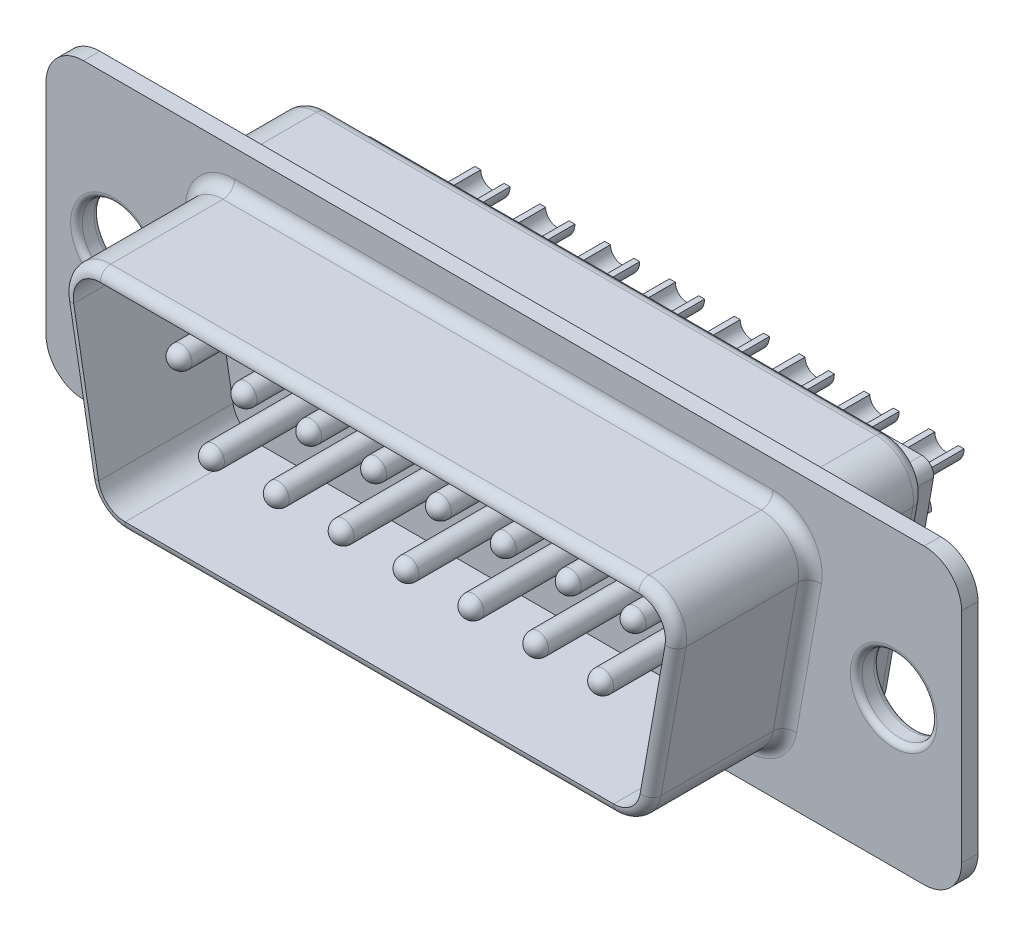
SolidWorks part; units mm, degrees
ref_plane "Front" through (0, 0, 0) normal (0, 0, 1) x (1, 0, 0)
ref_plane "Top" through (0, 0, 0) normal (0, 1, 0) x (1, 0, 0)
ref_plane "Right" through (0, 0, 0) normal (1, 0, 0) x (0, 0, -1)
sketch "Sketch1" plane through (0, 0, 0) normal (0, 0, 1) x (1, 0, 0)
  line L0 (0, 15.7999) -> (0, -16.2156) construction
  line L1 (-17.95, 6.265) -> (17.95, 6.265)
  line L2 (-19.55, 4.665) -> (-19.55, -4.665)
  line L3 (-17.95, -6.265) -> (17.95, -6.265)
  line L4 (19.55, 4.665) -> (19.55, -4.665)
  line L5 (-25.5708, 0) -> (26.8182, 0) construction
  arc A0 (17.95, 6.265) -> (19.55, 4.665) centre (17.95, 4.665) cw
  arc A1 (17.95, -6.265) -> (19.55, -4.665) centre (17.95, -4.665) ccw
  arc A2 (-19.55, -4.665) -> (-17.95, -6.265) centre (-17.95, -4.665) ccw
  arc A3 (-17.95, 6.265) -> (-19.55, 4.665) centre (-17.95, 4.665) ccw
  point P10 (19.55, 6.265)
  point P13 (19.55, -6.265)
  point P18 (-19.55, 6.265)
  dimension "D5" = 1.6
  dimension "D1" = 39.1
  dimension "D2" = 19.55
  dimension "D3" = 12.53
  dimension "D4" = 6.265
extrude "Extrude1" add sketch "Sketch1" against normal blind 0.7
sketch "Sketch2" plane through (0, 0, 0) normal (0, 0, 1) x (1, 0, 0)
  line L0 (0, -11.2848) -> (0, 18.2623) construction
  circle A0 centre (16.65, 0) radius 1.6
  circle A1 centre (-16.65, 0) radius 1.6
  dimension "D1" = 3.2
  dimension "D2" = 16.65
extrude "Cut-Extrude1" cut sketch "Sketch2" against normal through all
sketch "Sketch3" plane through (0, 0, 0) normal (0, 0, 1) x (1, 0, 0)
  line L0 (-11.4943, 4.615) -> (11.4943, 4.615)
  line L1 (-10.4311, -4.615) -> (10.4311, -4.615)
  line L2 (0, 11.4353) -> (0, -12.3443) construction
  line L3 (13.07, 2.7372) -> (12.0067, -3.2928)
  line L4 (-13.07, 2.7372) -> (-12.0067, -3.2928)
  arc A0 (11.4943, 4.615) -> (13.07, 2.7372) centre (11.4943, 3.015) cw
  arc A1 (-13.07, 2.7372) -> (-11.4943, 4.615) centre (-11.4943, 3.015) cw
  arc A2 (-10.4311, -4.615) -> (-12.0067, -3.2928) centre (-10.4311, -3.015) cw
  arc A3 (12.0067, -3.2928) -> (10.4311, -4.615) centre (10.4311, -3.015) cw
  dimension "D1" = 1.6
  dimension "D2" = 26.14
  dimension "D4" = 10
  dimension "D7" = 13.07
  dimension "D3" = 10
  dimension "D5" = 4.615
  dimension "D6" = 9.23
extrude "Extrude2" add sketch "Sketch3" along normal blind 5.74
fillet "Fillet1" radius 0.45 8 edges at (12.5384, -0.2778, 5.74) (11.4595, -4.2407, 5.74) (0, -4.615, 5.74) (-11.4595, -4.2407, 5.74) (-12.5384, -0.2778, 5.74) (-12.72, 4.0435, 5.74) (0, 4.615, 5.74) (12.72, 4.0435, 5.74)
sketch "Sketch4" plane through (0, 0, 5.74) normal (0, 0, 1) x (1, 0, 0)
  line L4 (11.5636, -3.2147) -> (12.6268, 2.8153)
  line L5 (11.4943, 4.165) -> (-11.4943, 4.165)
  line L6 (-12.6268, 2.8153) -> (-11.5636, -3.2147)
  line L7 (-10.4311, -4.165) -> (10.4311, -4.165)
  line L8 (11.5636, -3.2147) -> (12.6268, 2.8153)
  line L9 (11.4943, 4.165) -> (-11.4943, 4.165)
  line L10 (-12.6268, 2.8153) -> (-11.5636, -3.2147)
  line L11 (-10.4311, -4.165) -> (10.4311, -4.165)
  arc A4 (10.4311, -4.165) -> (11.5636, -3.2147) centre (10.4311, -3.015) ccw
  arc A5 (12.6268, 2.8153) -> (11.4943, 4.165) centre (11.4943, 3.015) ccw
  arc A6 (-11.4943, 4.165) -> (-12.6268, 2.8153) centre (-11.4943, 3.015) ccw
  arc A7 (-11.5636, -3.2147) -> (-10.4311, -4.165) centre (-10.4311, -3.015) ccw
  arc A8 (10.4311, -4.165) -> (11.5636, -3.2147) centre (10.4311, -3.015) ccw
  arc A9 (12.6268, 2.8153) -> (11.4943, 4.165) centre (11.4943, 3.015) ccw
  arc A10 (-11.4943, 4.165) -> (-12.6268, 2.8153) centre (-11.4943, 3.015) ccw
  arc A11 (-11.5636, -3.2147) -> (-10.4311, -4.165) centre (-10.4311, -3.015) ccw
  dimension "D1" = 0
extrude "Cut-Extrude2" cut sketch "Sketch4" against normal up to surface (5.74 mm away)
sketch "Sketch5" plane through (0, 0, 0) normal (0, 0, 1) x (1, 0, 0)
  line L0 (0, 7.7989) -> (0, -8.8516) construction
  line L1 (-16.65, 0) -> (16.65, 0) construction
  line L2 (0, -1.5) -> (2.77, -1.5) construction
  line L3 (0, -1.5) -> (-2.77, -1.5) construction
  line L4 (1.385, 1.5) -> (4.155, 1.5) construction
  line L5 (1.385, 1.5) -> (-1.385, 1.5) construction
  circle A0 centre (0, -1.5) radius 0.46
  circle A1 centre (2.77, -1.5) radius 0.46
  circle A2 centre (5.54, -1.5) radius 0.46
  circle A3 centre (8.31, -1.5) radius 0.46
  circle A4 centre (-2.77, -1.5) radius 0.46
  circle A5 centre (0, -1.5) radius 0.46
  circle A6 centre (2.77, -1.5) radius 0.46
  circle A7 centre (5.54, -1.5) radius 0.46
  circle A8 centre (-5.54, -1.5) radius 0.46
  circle A9 centre (-2.77, -1.5) radius 0.46
  circle A10 centre (0, -1.5) radius 0.46
  circle A11 centre (2.77, -1.5) radius 0.46
  circle A12 centre (-8.31, -1.5) radius 0.46
  circle A13 centre (-5.54, -1.5) radius 0.46
  circle A14 centre (-2.77, -1.5) radius 0.46
  circle A15 centre (0, -1.5) radius 0.46
  circle A16 centre (1.385, 1.5) radius 0.46
  circle A17 centre (4.155, 1.5) radius 0.46
  circle A18 centre (6.925, 1.5) radius 0.46
  circle A19 centre (9.695, 1.5) radius 0.46
  circle A20 centre (-1.385, 1.5) radius 0.46
  circle A21 centre (1.385, 1.5) radius 0.46
  circle A22 centre (4.155, 1.5) radius 0.46
  circle A23 centre (6.925, 1.5) radius 0.46
  circle A24 centre (-4.155, 1.5) radius 0.46
  circle A25 centre (-1.385, 1.5) radius 0.46
  circle A26 centre (1.385, 1.5) radius 0.46
  circle A27 centre (4.155, 1.5) radius 0.46
  circle A28 centre (-6.925, 1.5) radius 0.46
  circle A29 centre (-4.155, 1.5) radius 0.46
  circle A30 centre (-1.385, 1.5) radius 0.46
  circle A31 centre (1.385, 1.5) radius 0.46
  circle A32 centre (-9.695, 1.5) radius 0.46
  circle A33 centre (-6.925, 1.5) radius 0.46
  circle A34 centre (-4.155, 1.5) radius 0.46
  circle A35 centre (-1.385, 1.5) radius 0.46
  dimension "D1" = 0.92
  dimension "D2" = 1.5
  dimension "D3" = 1.385
  dimension "D4" = 1.5
sketch "Sketch6" plane through (0, 0, -0.7) normal (0, 0, -1) x (-1, 0, 0)
  line L0 (0, 8.0382) -> (0, -10.1913) construction
  line L1 (-16.65, 0) -> (16.65, 0) construction
  line L2 (-11.7441, 3.46) -> (11.7441, 3.46)
  line L4 (-11.9432, 5.385) -> (11.9432, 5.385)
  line L5 (13.5189, 3.5072) -> (12.1841, -4.0628)
  line L6 (-10.6084, -5.385) -> (10.6084, -5.385)
  line L7 (-13.5189, 3.5072) -> (-12.1841, -4.0628)
  line L8 (-10.7003, -3.46) -> (10.7003, -3.46)
  line L10 (12.2365, 2.8732) -> (11.1927, -3.0468)
  line L11 (-12.2365, 2.8732) -> (-11.1927, -3.0468)
  arc A0 (-11.9432, 5.385) -> (-13.5189, 3.5072) centre (-11.9432, 3.785) ccw
  arc A1 (13.5189, 3.5072) -> (11.9432, 5.385) centre (11.9432, 3.785) ccw
  arc A2 (10.6084, -5.385) -> (12.1841, -4.0628) centre (10.6084, -3.785) ccw
  arc A3 (-12.1841, -4.0628) -> (-10.6084, -5.385) centre (-10.6084, -3.785) ccw
  arc A4 (11.7441, 3.46) -> (12.2365, 2.8732) centre (11.7441, 2.96) cw
  arc A5 (-11.7441, 3.46) -> (-12.2365, 2.8732) centre (-11.7441, 2.96) ccw
  arc A6 (-10.7003, -3.46) -> (-11.1927, -3.0468) centre (-10.7003, -2.96) cw
  arc A7 (11.1927, -3.0468) -> (10.7003, -3.46) centre (10.7003, -2.96) cw
  dimension "D1" = 1.6
  dimension "D6" = 11.9432
  dimension "D7" = 11.9432
  dimension "D10" = 0.5
  dimension "D3" = 5.385
  dimension "D4" = 10
  dimension "D2" = 10.77
  dimension "D5" = 20
  dimension "D8" = 1.925
extrude "Extrude3" add sketch "Sketch6" along normal blind 3.75
fillet "Fillet2" radius 0.5 8 edges at (-13.1689, 4.8135, -4.45) (-12.8515, -0.2778, -4.45) (-11.6369, -5.0107, -4.45) (0, -5.385, -4.45) (11.6369, -5.0107, -4.45) (12.8515, -0.2778, -4.45) (13.1689, 4.8135, -4.45) (0, 5.385, -4.45)
sketch "Sketch7" plane through (0, 0, -0.7) normal (0, 0, -1) x (-1, 0, 0)
  line L4 (11.7441, 3.46) -> (-11.7441, 3.46)
  line L5 (-12.2365, 2.8732) -> (-11.1927, -3.0468)
  line L6 (-10.7003, -3.46) -> (10.7003, -3.46)
  line L7 (11.1927, -3.0468) -> (12.2365, 2.8732)
  line L8 (11.7441, 3.46) -> (-11.7441, 3.46)
  line L9 (-12.2365, 2.8732) -> (-11.1927, -3.0468)
  line L10 (-10.7003, -3.46) -> (10.7003, -3.46)
  line L11 (11.1927, -3.0468) -> (12.2365, 2.8732)
  arc A4 (12.2365, 2.8732) -> (11.7441, 3.46) centre (11.7441, 2.96) ccw
  arc A5 (-11.7441, 3.46) -> (-12.2365, 2.8732) centre (-11.7441, 2.96) ccw
  arc A6 (-11.1927, -3.0468) -> (-10.7003, -3.46) centre (-10.7003, -2.96) ccw
  arc A7 (10.7003, -3.46) -> (11.1927, -3.0468) centre (10.7003, -2.96) ccw
  arc A8 (12.2365, 2.8732) -> (11.7441, 3.46) centre (11.7441, 2.96) ccw
  arc A9 (-11.7441, 3.46) -> (-12.2365, 2.8732) centre (-11.7441, 2.96) ccw
  arc A10 (-11.1927, -3.0468) -> (-10.7003, -3.46) centre (-10.7003, -2.96) ccw
  arc A11 (10.7003, -3.46) -> (11.1927, -3.0468) centre (10.7003, -2.96) ccw
  dimension "D1" = 0
extrude "Extrude4" add sketch "Sketch7" along normal blind 5.41
sketch "Sketch8" plane through (0, 0, -6.11) normal (0, 0, -1) x (-1, 0, 0)
  line L0 (0, 8.7559) -> (0, -8.5166) construction
  line L1 (-16.65, 0) -> (16.65, 0) construction
  line L2 (1.385, 1.5) -> (4.155, 1.5) construction
  line L3 (1.385, 1.5) -> (-1.385, 1.5) construction
  line L4 (0, -1.5) -> (2.77, -1.5) construction
  line L5 (0, -1.5) -> (-2.77, -1.5) construction
  circle A0 centre (0, -1.5) radius 0.75
  circle A1 centre (1.385, 1.5) radius 0.75
  circle A2 centre (4.155, 1.5) radius 0.75
  circle A3 centre (6.925, 1.5) radius 0.75
  circle A4 centre (9.695, 1.5) radius 0.75
  circle A5 centre (-1.385, 1.5) radius 0.75
  circle A6 centre (1.385, 1.5) radius 0.75
  circle A7 centre (4.155, 1.5) radius 0.75
  circle A8 centre (6.925, 1.5) radius 0.75
  circle A9 centre (-4.155, 1.5) radius 0.75
  circle A10 centre (-1.385, 1.5) radius 0.75
  circle A11 centre (1.385, 1.5) radius 0.75
  circle A12 centre (4.155, 1.5) radius 0.75
  circle A13 centre (-6.925, 1.5) radius 0.75
  circle A14 centre (-4.155, 1.5) radius 0.75
  circle A15 centre (-1.385, 1.5) radius 0.75
  circle A16 centre (1.385, 1.5) radius 0.75
  circle A17 centre (-9.695, 1.5) radius 0.75
  circle A18 centre (-6.925, 1.5) radius 0.75
  circle A19 centre (-4.155, 1.5) radius 0.75
  circle A20 centre (-1.385, 1.5) radius 0.75
  circle A21 centre (2.77, -1.5) radius 0.75
  circle A22 centre (5.54, -1.5) radius 0.75
  circle A23 centre (8.31, -1.5) radius 0.75
  circle A24 centre (-2.77, -1.5) radius 0.75
  circle A25 centre (0, -1.5) radius 0.75
  circle A26 centre (2.77, -1.5) radius 0.75
  circle A27 centre (5.54, -1.5) radius 0.75
  circle A28 centre (-5.54, -1.5) radius 0.75
  circle A29 centre (-2.77, -1.5) radius 0.75
  circle A30 centre (0, -1.5) radius 0.75
  circle A31 centre (2.77, -1.5) radius 0.75
  circle A32 centre (-8.31, -1.5) radius 0.75
  circle A33 centre (-5.54, -1.5) radius 0.75
  circle A34 centre (-2.77, -1.5) radius 0.75
  circle A35 centre (0, -1.5) radius 0.75
  dimension "D1" = 1.5
  dimension "D2" = 1.5
  dimension "D3" = 1.5
  dimension "D4" = 1.385
extrude "Extrude5" add sketch "Sketch8" along normal blind 3.1 contours A17 | A13 | A9 | A5 | A1 | A2 | A3 | A4 | A32 | A28 | A24 | A0 | A21 | A22 | A23
ref_plane "Plane1" through (0, 1.5, 0) normal (0, 1, 0) x (-1, 0, 0)
ref_plane "Plane2" through (0, -1.5, 0) normal (0, 1, 0) x (-1, 0, 0)
sketch "Sketch9" plane through (0, 1.5, 0) normal (0, 1, 0) x (-1, 0, 0)
  line L0 (-10.445, -9.21) -> (-8.945, -9.21) construction
  line L1 (-10.445, -9.21) -> (10.445, -9.21)
  line L2 (-10.445, -9.21) -> (-10.445, -7.21)
  line L3 (-10.445, -7.21) -> (10.445, -7.21)
  line L4 (10.445, -9.21) -> (10.445, -7.21)
  line L5 (10.445, -9.21) -> (10.445, -6.11) construction
  line L6 (-10.445, -6.11) -> (-10.445, -9.21) construction
  dimension "D1" = 2
extrude "Cut-Extrude4" cut sketch "Sketch9" along normal blind 3.1
sketch "Sketch10" plane through (0, -1.5, 0) normal (0, 1, 0) x (-1, 0, 0)
  line L1 (-10.445, -9.21) -> (10.445, -9.21)
  line L2 (-10.445, -9.21) -> (-10.445, -7.21)
  line L3 (-10.445, -7.21) -> (10.445, -7.21)
  line L4 (10.445, -9.21) -> (10.445, -7.21)
extrude "Cut-Extrude5" cut sketch "Sketch10" against normal blind 3.1
fillet "Fillet3" radius 0.25 2 edges at (-18.25, 0, 0) (18.25, 0, 0)
sketch "Sketch12" plane through (0, 0, -0.7) normal (0, 0, -1) x (-1, 0, 0)
  circle A0 centre (16.65, 0) radius 1.6 construction
  circle A1 centre (-16.65, 0) radius 1.6 construction
  circle A2 centre (16.65, 0) radius 1.6
  circle A3 centre (-16.65, 0) radius 1.6
  circle A4 centre (-16.65, 0) radius 2.15
  circle A5 centre (16.65, 0) radius 2.15
  dimension "D1" = 4.3
extrude "Extrude6" add sketch "Sketch12" along normal blind 0.3
fillet "Fillet4" radius 0.25 2 edges at (-18.25, 0, -1) (15.05, 0, -1)
fillet "Fillet5" radius 0.5 8 edges at (12.72, 4.0435, 0) (12.5384, -0.2778, 0) (11.4595, -4.2407, 0) (0, -4.615, 0) (-11.4595, -4.2407, 0) (-12.5384, -0.2778, 0) (-12.72, 4.0435, 0) (0, 4.615, 0)
fillet "Fillet6" radius 0.5 8 edges at (-13.1689, 4.8135, -0.7) (-12.8515, -0.2778, -0.7) (-11.6369, -5.0107, -0.7) (0, -5.385, -0.7) (11.6369, -5.0107, -0.7) (12.8515, -0.2778, -0.7) (13.1689, 4.8135, -0.7) (0, 5.385, -0.7)
extrude "Extrude7" add sketch "Sketch5" along normal blind 4.54 contours A32 | A28 | A24 | A20 | A16 | A17 | A18 | A19 | A3 | A2 | A1 | A0 | A4 | A8 | A12
sketch "Sketch13" plane through (0, 0, -9.21) normal (0, 0, -1) x (-1, 0, 0)
  line L0 (-10.445, 1.5) -> (-8.945, 1.5) construction
  line L1 (-9.06, -1.5) -> (-7.56, -1.5) construction
  circle A0 centre (-9.695, 1.5) radius 0.5
  circle A1 centre (-8.31, -1.5) radius 0.5
  circle A2 centre (-6.925, 1.5) radius 0.5
  circle A3 centre (-4.155, 1.5) radius 0.5
  circle A4 centre (-1.385, 1.5) radius 0.5
  circle A5 centre (1.385, 1.5) radius 0.5
  circle A6 centre (4.155, 1.5) radius 0.5
  circle A7 centre (6.925, 1.5) radius 0.5
  circle A8 centre (9.695, 1.5) radius 0.5
  circle A9 centre (-5.54, -1.5) radius 0.5
  circle A10 centre (-2.77, -1.5) radius 0.5
  circle A11 centre (0, -1.5) radius 0.5
  circle A12 centre (2.77, -1.5) radius 0.5
  circle A13 centre (5.54, -1.5) radius 0.5
  circle A14 centre (8.31, -1.5) radius 0.5
  dimension "D1" = 1
  dimension "D2" = 2.77
  dimension "D3" = 2.77
extrude "Cut-Extrude6" cut sketch "Sketch13" against normal up to surface (4.76 mm away)
fillet "Fillet7" radius 0.46 15 edges at (-9.235, 1.5, 4.54) (-7.85, -1.5, 4.54) (-5.08, -1.5, 4.54) (-2.31, -1.5, 4.54) (0.46, -1.5, 4.54) (3.23, -1.5, 4.54) (6, -1.5, 4.54) (8.77, -1.5, 4.54) (10.155, 1.5, 4.54) (7.385, 1.5, 4.54) (4.615, 1.5, 4.54) (1.845, 1.5, 4.54) (-0.925, 1.5, 4.54) (-3.695, 1.5, 4.54) (-6.465, 1.5, 4.54)
equation "\"D2@Sketch1\" = \"D1@Sketch1\"/2"
equation "\"D4@Sketch1\" =  \"D3@Sketch1\"/2"
equation "\"D7@Sketch6\" = \"D6@Sketch6\""
